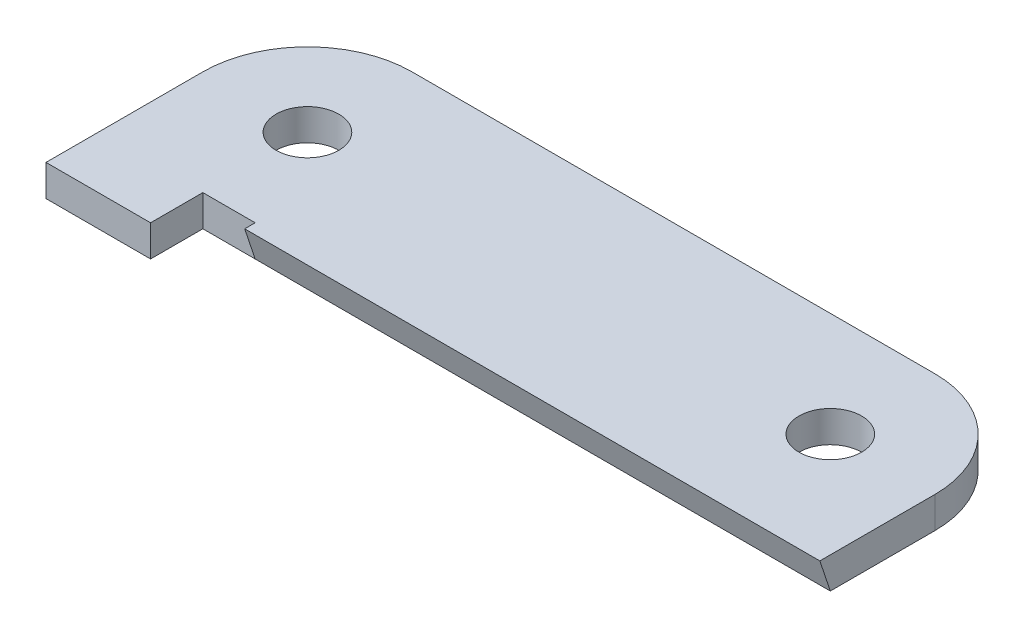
SolidWorks part; units mm, degrees
ref_plane "Front" through (0, 0, 0) normal (0, 0, 1) x (1, 0, 0)
ref_plane "Top" through (0, 0, 0) normal (0, 1, 0) x (1, 0, 0)
ref_plane "Right" through (0, 0, 0) normal (1, 0, 0) x (0, 0, -1)
sketch "Sketch1" plane through (0, 0, 0) normal (0, 1, 0) x (1, 0, 0)
  line L0 (10, 0) -> (10, 5)
  line L1 (0, 0) -> (10, 0)
  line L2 (0, 0) -> (0, 15)
  line L3 (10, 25) -> (60, 25)
  line L4 (70, 4) -> (70, 15)
  line L5 (15, 4) -> (15, 5)
  line L6 (10, 5) -> (15, 5)
  line L7 (15, 4) -> (70, 4)
  line L8 (0, 5) -> (70, 5) construction
  line L9 (15, 0) -> (15, 25) construction
  line L10 (10, 0) -> (10, 25) construction
  line L11 (0, 0) -> (0, 25) construction
  line L12 (0, 25) -> (70, 25) construction
  circle A0 centre (10, 15) radius 3
  circle A1 centre (60, 15) radius 3
  arc A2 (0, 15) -> (10, 25) centre (10, 15) cw
  arc A3 (70, 15) -> (60, 25) centre (60, 15) ccw
extrude "Extrude1" add sketch "Sketch1" along normal blind 3
sketch "Sketch2" plane through (70, 0, 0) normal (1, 0, 0) x (0, 0, -1)
  line L0 (4, 3) -> (4, 0)
  line L1 (4, 0) -> (5, 0)
  line L2 (4, 0) -> (15, 0) construction
  line L3 (5, 0) -> (4, 3)
extrude "Cut-Extrude1" cut sketch "Sketch2" against normal blind 55
